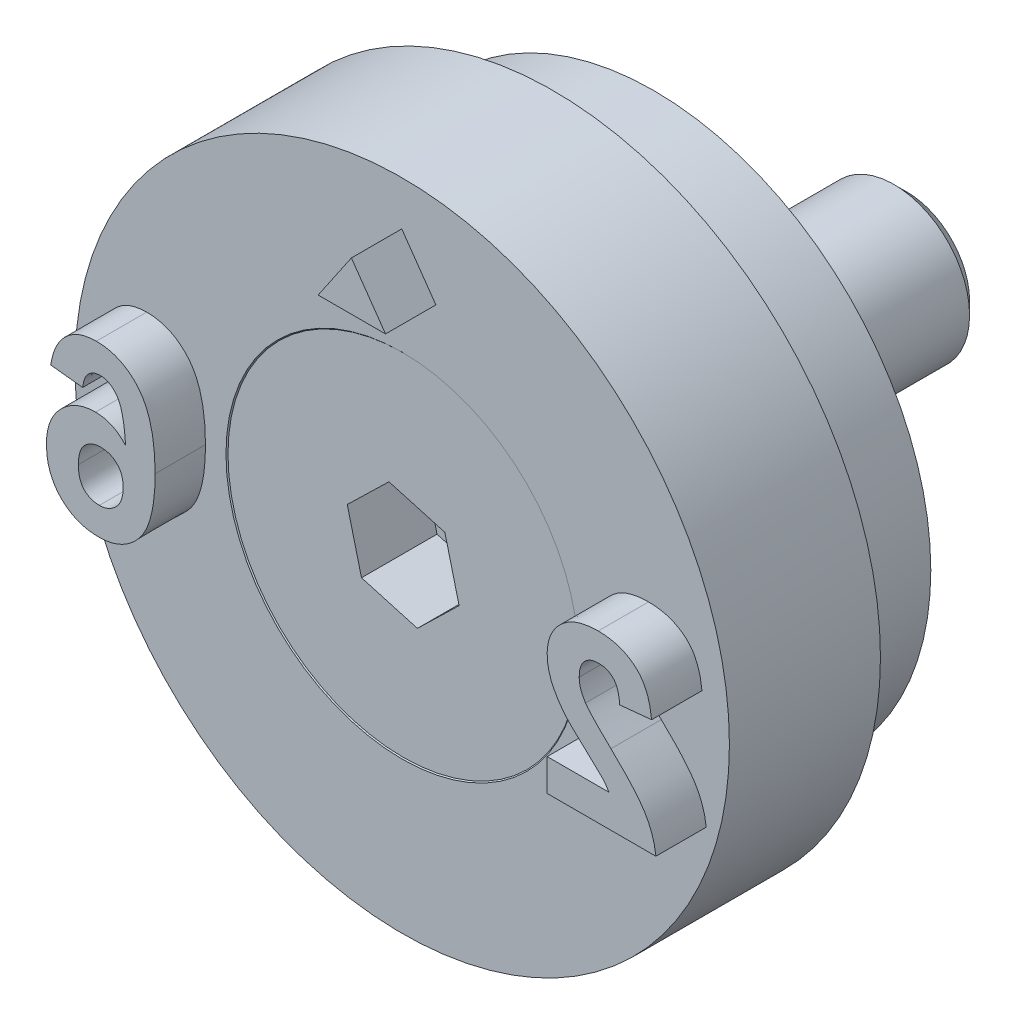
SolidWorks part; units mm, degrees
other "<M3 X .5 FHCS>-<Imported1>"
ref_plane "Front Plane" through (0, 0, 0) normal (0, 0, 1) x (1, 0, 0)
ref_plane "Top Plane" through (0, 0, 0) normal (0, 1, 0) x (1, 0, 0)
ref_plane "Right Plane" through (0, 0, 0) normal (1, 0, 0) x (0, 0, -1)
imported_body "Imported1"
other "DeleteFace1"
sketch "Sketch1" plane through (0, 0, 0) normal (0, 0, 1) x (1, 0, 0)
  line L0 (-0.0087, 5.6166) -> (-0.6694, 4.6482)
  line L1 (-0.6694, 4.6482) -> (0.6694, 4.6482)
  line L2 (0.6694, 4.6482) -> (-0.0087, 5.6166)
  text T0 "2      6" font "Arial" height 3.302
  dimension "D1" = 1.651
extrude "Boss-Extrude1" add sketch "Sketch1" along normal blind 1
inserted part "M3 X .5 FHCS"
move or copy body "Body-Move/Copy2" placed by mates yes
